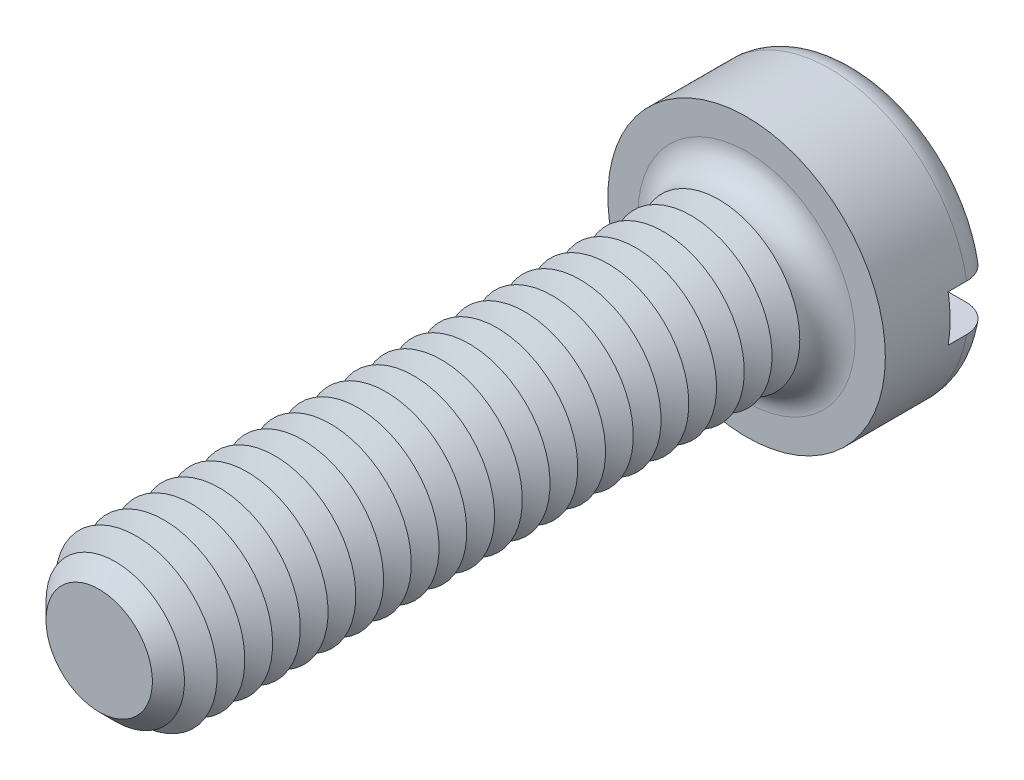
SolidWorks part; units mm, degrees
ref_plane "Front Plane" through (0, 0, 0) normal (0, 0, 1) x (1, 0, 0)
ref_plane "Top Plane" through (0, 0, 0) normal (0, 1, 0) x (1, 0, 0)
ref_plane "Right Plane" through (0, 0, 0) normal (1, 0, 0) x (0, 0, -1)
sketch "Sketch3" plane through (0, 0, 0) normal (0, 0, 1) x (1, 0, 0)
  circle A0 centre (0, 0) radius 3
  dimension "D1" = 6
extrude "Boss-Extrude2" add sketch "Sketch3" against normal blind 2.4
sketch "Sketch4" plane through (0, 0, 0) normal (0, 0, 1) x (1, 0, 0)
  circle A0 centre (0, 0) radius 1.75
  dimension "D1" = 3.5
extrude "Boss-Extrude3" add sketch "Sketch4" along normal blind 14
fillet "Fillet1" radius 0.6 2 edges at (3, 0, -2.4) (1.75, 0, 0)
chamfer "Chamfer1" distance 0.6 angle 45 1 edges at (1.75, 0, 14)
sketch "Sketch5" plane through (0, 0, 0) normal (1, 0, 0) x (0, 0, -1)
  line L0 (1.6944, 0) -> (-7.6738, 0) construction
sketch "Sketch6" plane through (0, 0, 0) normal (1, 0, 0) x (0, 0, -1)
  line L0 (-0.6, 1.75) -> (-0.9, 1.2304)
  line L1 (-0.9, 1.2304) -> (-1.2, 1.75)
  line L2 (-0.6, 1.75) -> (-13.4, 1.75) construction
  line L3 (-1.2, 1.75) -> (-0.6, 1.75)
  dimension "D1" = 0.6
revolve "Cut-Revolve1" cut sketch "Sketch6" angle 360 about L0
pattern_linear "LPattern1" count 22 spacing 0.6 along (0, 0, 1) of "Cut-Revolve1"
sketch "Sketch8" plane through (0, 0, -2.4) normal (0, 0, -1) x (-1, 0, 0)
  line L1 (3, -0.5) -> (-3, -0.5)
  line L2 (3, -0.5) -> (3, 0.5)
  line L3 (3, 0.5) -> (-3, 0.5)
  line L4 (-3, -0.5) -> (-3, 0.5)
  line L5 (3, -0.5) -> (-3, 0.5) construction
  line L6 (3, 0.5) -> (-3, -0.5) construction
  point P0 (0, 0)
  dimension "D1" = 6
  dimension "D2" = 1
extrude "Cut-Extrude1" cut sketch "Sketch8" against normal blind 1
